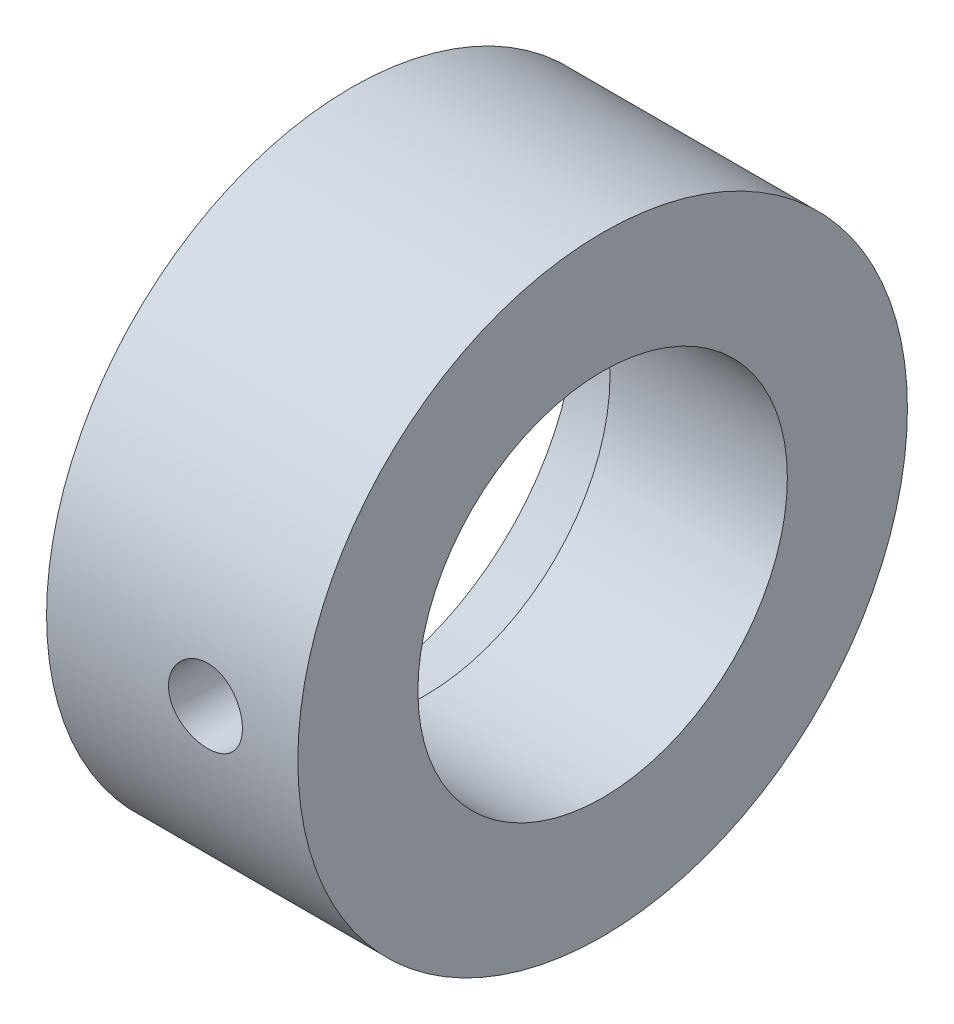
SolidWorks part; units mm, degrees
ref_plane "Front" through (0, 0, 0) normal (0, 0, 1) x (1, 0, 0)
ref_plane "Top" through (0, 0, 0) normal (0, 1, 0) x (1, 0, 0)
ref_plane "Right" through (0, 0, 0) normal (1, 0, 0) x (0, 0, -1)
sketch "Esquisse1" plane through (0, 0, 0) normal (0, 0, 1) x (1, 0, 0)
  line L0 (8.5811, 52.5) -> (34.0961, 52.5) construction
  line L1 (13, 64.65) -> (13, 69)
  line L2 (13, 69) -> (26.6, 69)
  line L3 (26.6, 69) -> (26.6, 62.5)
  line L4 (26.6, 62.5) -> (17, 62.5)
  line L5 (17, 62.5) -> (17, 66.1059)
  line L6 (17, 66.1059) -> (13, 64.65)
revolve "Révolution2" add sketch "Esquisse1" angle 360 about L0
sketch "Esquisse7" plane through (0, 0, 0) normal (0, 0, 1) x (1, 0, 0)
  line L0 (26.6, 36) -> (26.6, 69) construction
  line L1 (13, 36) -> (26.6, 36) construction
  circle A0 centre (21.6, 52.5) radius 2
  dimension "D1" = 4
  dimension "D3" = 16.5
  dimension "D2" = 5
extrude "Enlèv. mat.-Extru.1" cut sketch "Esquisse7" along normal blind 20
